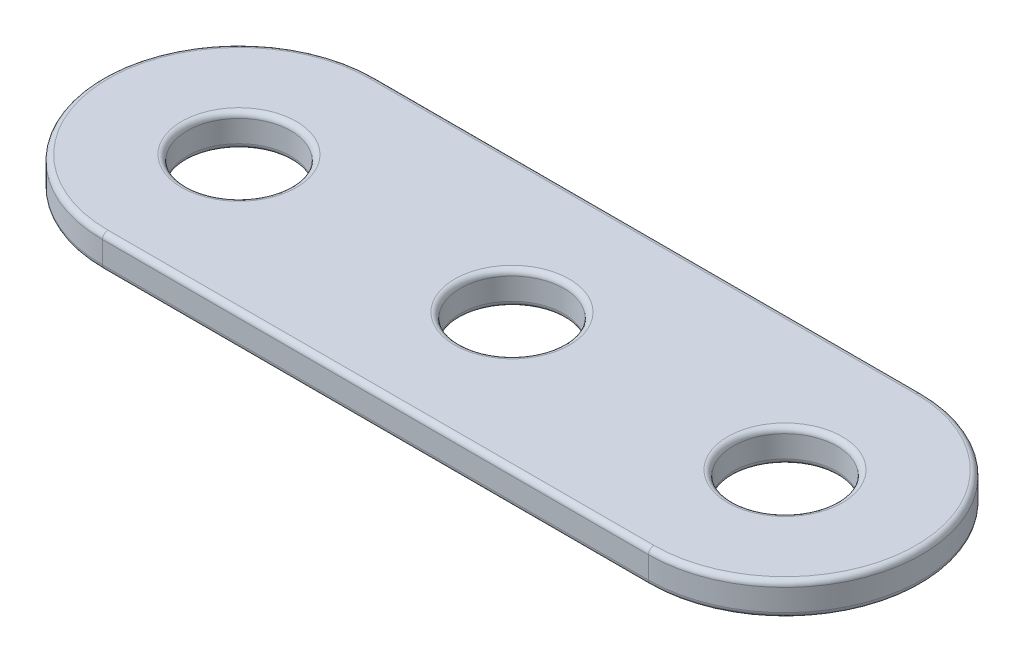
SolidWorks part; units mm, degrees
ref_plane "Front" through (0, 0, 0) normal (0, 0, 1) x (1, 0, 0)
ref_plane "Top" through (0, 0, 0) normal (0, 1, 0) x (1, 0, 0)
ref_plane "Right" through (0, 0, 0) normal (1, 0, 0) x (0, 0, -1)
sketch "Sketch1" plane through (0, 0, 0) normal (0, 1, 0) x (1, 0, 0)
  line L1 (0, 0) -> (25.4, 0)
  line L3 (0, 12.7) -> (25.4, 12.7)
  arc A0 (0, 12.7) -> (0, 0) centre (0, 6.35) ccw
  arc A1 (25.4, 0) -> (25.4, 12.7) centre (25.4, 6.35) ccw
  dimension "D1" = 12.7
  dimension "D2" = 25.4
extrude "Extrude1" add sketch "Sketch1" along normal blind 1.524
sketch "Sketch2" plane through (0, 1.524, 0) normal (0, 1, 0) x (-1, 0, 0)
  line L0 (-25.4, -12.7) -> (0, -12.7) construction
  circle A0 centre (0, -6.35) radius 2.413
  dimension "D2" = 4.826
  dimension "D1" = 6.35
extrude "Cut-Extrude1" cut sketch "Sketch2" against normal through all
pattern_linear "LPattern1" count 3 spacing 12.7 along (1, 0, 0) of "Cut-Extrude1"
fillet "Fillet1" radius 0.254 14 edges at (31.75, 1.524, -6.35) (12.7, 1.524, -12.7) (0, 0, -3.937) (0, 1.524, -3.937) (12.7, 0, -3.937) (12.7, 1.524, -3.937) (25.4, 0, -3.937) (25.4, 1.524, -3.937) (-6.35, 1.524, -6.35) (12.7, 0, -12.7) (31.75, 0, -6.35) (12.7, 0, 0) (-6.35, 0, -6.35) (12.7, 1.524, 0)
equation "\"D2@Sketch1\" = \"D3@LPattern1\" *  ( \"D1@LPattern1\" - 1 ) "
